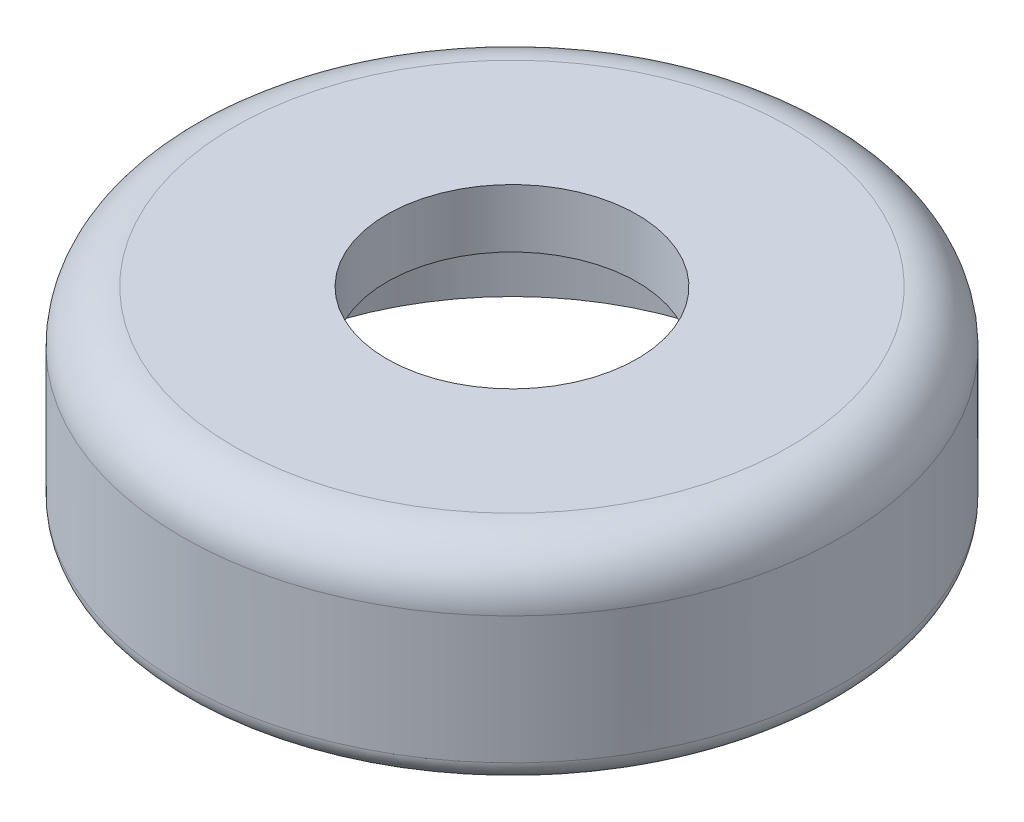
SolidWorks part; units mm, degrees
ref_plane "Front" through (0, 0, 0) normal (0, 0, 1) x (1, 0, 0)
ref_plane "Top" through (0, 0, 0) normal (0, 1, 0) x (1, 0, 0)
ref_plane "Right" through (0, 0, 0) normal (1, 0, 0) x (0, 0, -1)
sketch "Sketch1" plane through (0, 0, 0) normal (0, 0, 1) x (1, 0, 0)
  line L1 (0, 0) -> (0, 30.3087) construction
  line L2 (-8.255, 0) -> (-10.033, 0)
  line L3 (-10.033, 0) -> (-10.033, 6.096)
  line L4 (-10.033, 6.096) -> (0, 6.096)
  line L5 (0, 6.096) -> (0, 4.318)
  line L6 (0, 4.318) -> (-8.255, 4.318)
  line L7 (-8.255, 4.318) -> (-8.255, 0)
  dimension "D1" = 16.51
  dimension "D2" = 20.066
  dimension "D3" = 6.096
  dimension "D4" = 1.778
revolve "Base-Revolve" add sketch "Sketch1" angle 360 about L1
fillet "Fillet1" radius 1.5875 1 edges at (0, 6.096, -10.033)
sketch "Sketch2" plane through (0, 6.096, 0) normal (0, 1, 0) x (-1, 0, 0)
  circle A0 centre (0, 0) radius 3.81
  dimension "D1" = 7.62
extrude "Cut-Extrude1" cut sketch "Sketch2" against normal through all
fillet "Fillet2" radius 0.635 1 edges at (0, 0, -10.033)
